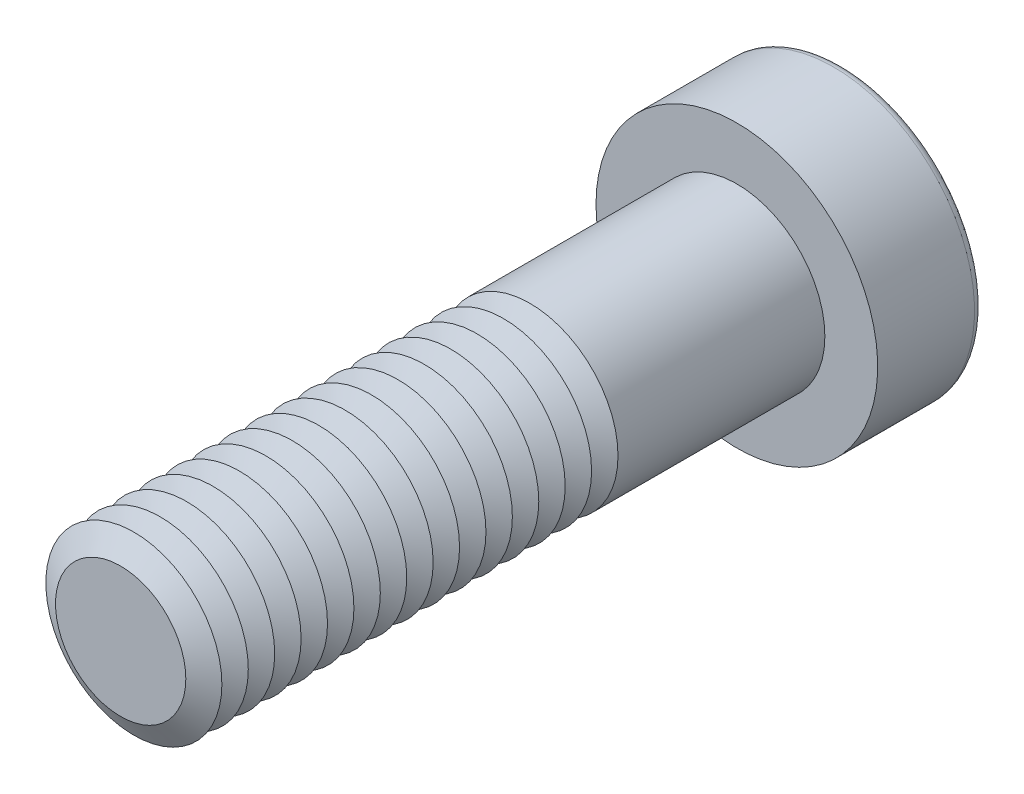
SolidWorks part; units mm, degrees
ref_plane "Front Plane" through (0, 0, 0) normal (0, 0, 1) x (1, 0, 0)
ref_plane "Top Plane" through (0, 0, 0) normal (0, 1, 0) x (1, 0, 0)
ref_plane "Right Plane" through (0, 0, 0) normal (1, 0, 0) x (0, 0, -1)
sketch "Sketch1" plane through (0, 0, 0) normal (0, 0, 1) x (1, 0, 0)
  circle A0 centre (0, 0) radius 5
  dimension "D1" = 10
extrude "Boss-Extrude1" add sketch "Sketch1" along normal blind 35
sketch "Sketch2" plane through (0, 0, 0) normal (0, 0, -1) x (-1, 0, 0)
  circle A0 centre (0, 0) radius 8
  dimension "D1" = 16
extrude "Boss-Extrude2" add sketch "Sketch2" along normal blind 6
sketch "Sketch3" plane through (0, 0, -6) normal (0, 0, -1) x (-1, 0, 0)
  line L1 (-2.0207, 3.5) -> (-4.0415, 0)
  line L2 (-4.0415, 0) -> (-2.0207, -3.5)
  line L3 (-2.0207, -3.5) -> (2.0207, -3.5)
  line L4 (2.0207, -3.5) -> (4.0415, 0)
  line L5 (4.0415, 0) -> (2.0207, 3.5)
  line L6 (2.0207, 3.5) -> (-2.0207, 3.5)
  circle A0 centre (0, 0) radius 3.5 construction
  dimension "D1" = 7
extrude "Cut-Extrude1" cut sketch "Sketch3" against normal blind 5.25
fillet "Fillet1" radius 0.5 1 edges at (-8, 0, -6)
sketch "Sketch4" plane through (0, 0, -0.75) normal (0, 0, -1) x (-1, 0, 0)
  line L0 (2.0207, -3.5) -> (4.0415, 0) construction
  circle A0 centre (0, 0) radius 3.5
extrude "Cut-Extrude2" cut sketch "Sketch4" against normal through all draft 60
sketch "Sketch5" plane through (0, 0, -6) normal (0, 0, -1) x (-1, 0, 0)
  circle A0 centre (0, 0) radius 4.0415
extrude "Cut-Extrude3" cut sketch "Sketch5" against normal through all draft 75
sketch "Sketch7" plane through (0, 0, 0) normal (1, 0, 0) x (0, 0, -1)
  line L25 (-35, 3.701) -> (-34.25, 5)
  line L26 (-35, 5) -> (-35, -5) construction
  line L27 (-34.25, 5) -> (-35.75, 5)
  line L28 (-35.75, 5) -> (-35, 3.701)
  line L29 (0, 5) -> (-35, 5) construction
  dimension "D1" = 1.5
revolve "Cut-Revolve1" cut sketch "Sketch7" angle 360 about axis through (0, 0, 35) along (0, 0, -1)
pattern_linear "LPattern1" count 16 spacing 1.5 along (0, 0, -1) of "Cut-Revolve1"
